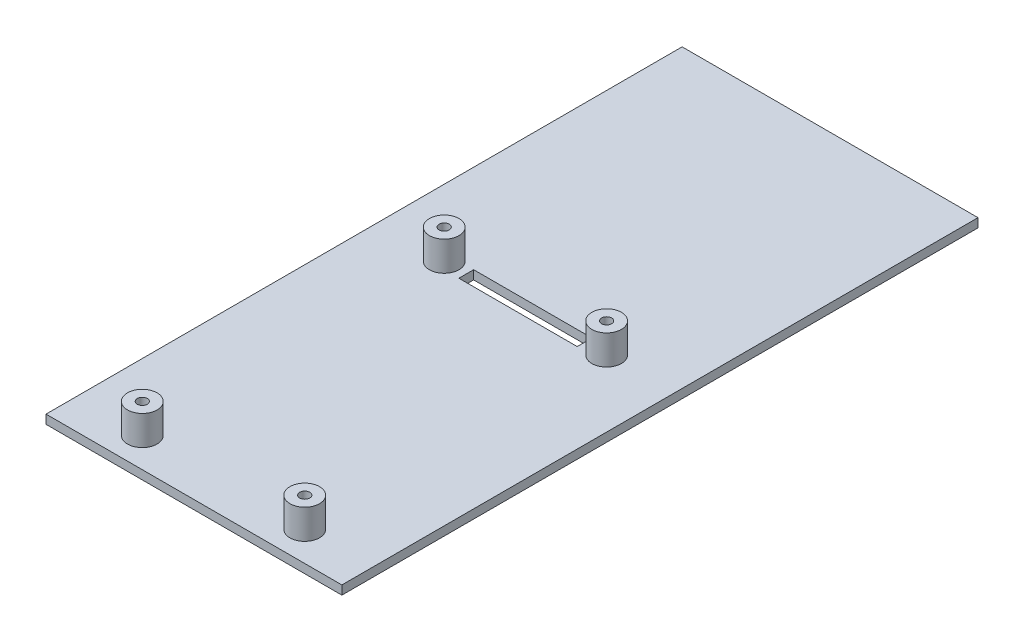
SolidWorks part; units mm, degrees
ref_plane "Piano frontale" through (0, 0, 0) normal (0, 0, 1) x (1, 0, 0)
ref_plane "Piano superiore" through (0, 0, 0) normal (0, 1, 0) x (1, 0, 0)
ref_plane "Piano destro" through (0, 0, 0) normal (1, 0, 0) x (0, 0, -1)
sketch "Schizzo18" plane through (0, 0, 0) normal (0, 1, 0) x (1, 0, 0)
  line L1 (-50, 107.5) -> (50, 107.5)
  line L2 (-50, 107.5) -> (-50, -107.5)
  line L3 (-50, -107.5) -> (50, -107.5)
  line L4 (50, 107.5) -> (50, -107.5)
  line L5 (-50, 107.5) -> (50, -107.5) construction
  line L6 (-50, -107.5) -> (50, 107.5) construction
  point P0 (0, 0)
extrude "Estrusione-Estrusione6" add sketch "Schizzo18" along normal blind 3
sketch "Schizzo19" plane through (0, 3, 0) normal (0, 1, 0) x (1, 0, 0)
  line L0 (50, 107.5) -> (-50, 107.5) construction
  line L1 (-40, 97.5) -> (40, 97.5)
  line L2 (-40, 97.5) -> (-40, 17.5)
  line L3 (-40, 17.5) -> (40, 17.5)
  line L4 (40, 97.5) -> (40, 17.5)
  line L5 (-40, 97.5) -> (40, 17.5) construction
  line L6 (-40, 17.5) -> (40, 97.5) construction
  line L7 (-27.45, 4.54) -> (27.45, 4.54)
  line L8 (-27.45, 4.54) -> (-27.45, -97.5)
  line L9 (-27.45, -97.5) -> (27.45, -97.5)
  line L10 (27.45, 4.54) -> (27.45, -97.5)
  line L11 (-27.45, 4.54) -> (27.45, -97.5) construction
  line L12 (-27.45, -97.5) -> (27.45, 4.54) construction
  line L13 (-50, -107.5) -> (50, -107.5) construction
  point P0 (0, 57.5)
  point P5 (0, -46.48)
sketch "Schizzo22" plane through (0, 3, 0) normal (0, 1, 0) x (1, 0, 0)
  circle A0 centre (-27.45, 4.54) radius 5
  circle A2 centre (-27.45, -97.5) radius 5
  circle A3 centre (27.45, 4.54) radius 5
  circle A4 centre (27.45, -97.5) radius 5
  dimension "D1" = 10
  dimension "D2" = 10
  dimension "D3" = 2
extrude "Estrusione-Estrusione7" add sketch "Schizzo22" along normal blind 10
hole_wizard "Foro per Vite M3-1" positions "Schizzo25" profile "Schizzo26" hole size "M3" standard "ISO"
sketch "Schizzo25" plane through (0, 13, 0) normal (0, 1, 0) x (1, 0, 0)
  point P0 (-27.45, 4.54)
  point P3 (-27.45, -97.5)
  point P6 (27.45, -97.5)
  point P9 (27.45, 4.54)
sketch "Schizzo26" plane through (-27.45, 13, -4.54) normal (1, 0, 0) x (0, 0, 1)
  line L0 (0, 0) -> (0, 13)
  line L1 (0, 13) -> (1.7, 13)
  line L2 (1.7, 13) -> (1.7, 0)
  line L5 (1.7, 0) -> (0, 0)
  line L11 (0, -6.35) -> (0, 107.95) construction
  dimension "Thru Hole Dia." = 3.4
  dimension "Thru Hole Depth" = 13
sketch "Schizzo27" plane through (0, 3, 0) normal (0, 1, 0) x (1, 0, 0)
  line L0 (-27.45, 4.54) -> (27.45, 4.54) construction
  line L1 (-20, 7.04) -> (20, 7.04)
  line L2 (-20, 7.04) -> (-20, 2.04)
  line L3 (-20, 2.04) -> (20, 2.04)
  line L4 (20, 7.04) -> (20, 2.04)
  line L5 (-20, 7.04) -> (20, 2.04) construction
  line L6 (-20, 2.04) -> (20, 7.04) construction
  point P0 (0, 4.54)
  dimension "D1" = 40
  dimension "D2" = 5
extrude "Taglio-Estrusione1" cut sketch "Schizzo27" against normal through all
equation "\"D1@Schizzo18\"=10+105+10+80+10"
equation "\"D7@Schizzo19\"=\"D6@Schizzo19\"/2"
